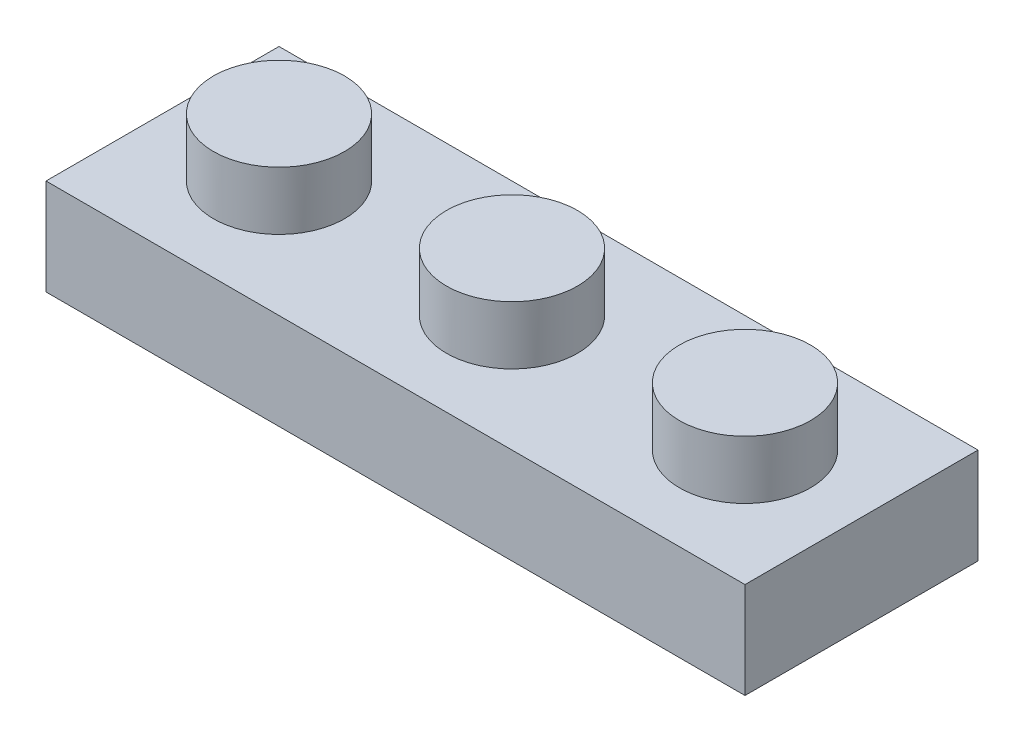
SolidWorks part; units mm, degrees
ref_plane "Front Plane" through (0, 0, 0) normal (0, 0, 1) x (1, 0, 0)
ref_plane "Top Plane" through (0, 0, 0) normal (0, 1, 0) x (1, 0, 0)
ref_plane "Right Plane" through (0, 0, 0) normal (1, 0, 0) x (0, 0, -1)
sketch "Sketch1" plane through (0, 0, 0) normal (0, 1, 0) x (1, 0, 0)
  line L1 (0, 0) -> (24, 0)
  line L2 (0, 0) -> (0, 8)
  line L3 (0, 8) -> (24, 8)
  line L4 (24, 0) -> (24, 8)
  dimension "D1" = 24
  dimension "D2" = 8
extrude "Extrude1" add sketch "Sketch1" along normal blind 3.3
sketch "Sketch2" plane through (0, 3.3, 0) normal (0, 1, 0) x (1, 0, 0)
  circle A0 centre (4, 4) radius 2.25
  point P6 (9.3567, 6.1688)
  dimension "D1" = 4.5
extrude "Extrude2" add sketch "Sketch2" along normal blind 2
sketch "Sketch3" plane through (0, 0, 0) normal (0, -1, 0) x (1, 0, 0)
  line L0 (24, 0) -> (24, -8) construction
  line L1 (17.75, -1.75) -> (22.25, -1.75)
  line L2 (17.75, -1.75) -> (17.75, -6.25)
  line L3 (17.75, -6.25) -> (22.25, -6.25)
  line L4 (22.25, -1.75) -> (22.25, -6.25)
  line L5 (24, -8) -> (0, -8) construction
  dimension "D1" = 4.5
  dimension "D2" = 1.75
  dimension "D3" = 1.75
extrude "Extrude3" cut sketch "Sketch3" against normal blind 2.5
sketch "Sketch4" plane through (0, 3.3, 0) normal (0, 1, 0) x (1, 0, 0)
  line L0 (0, 4) -> (35.7528, 4) construction
  line L1 (0, 8) -> (0, 0) construction
pattern_linear "LPattern1" count 4 spacing 8 along (1, 0, 0) of "Extrude2"
pattern_linear "LPattern2" count 4 spacing 8 along (-1, 0, 0) of "Extrude3"
